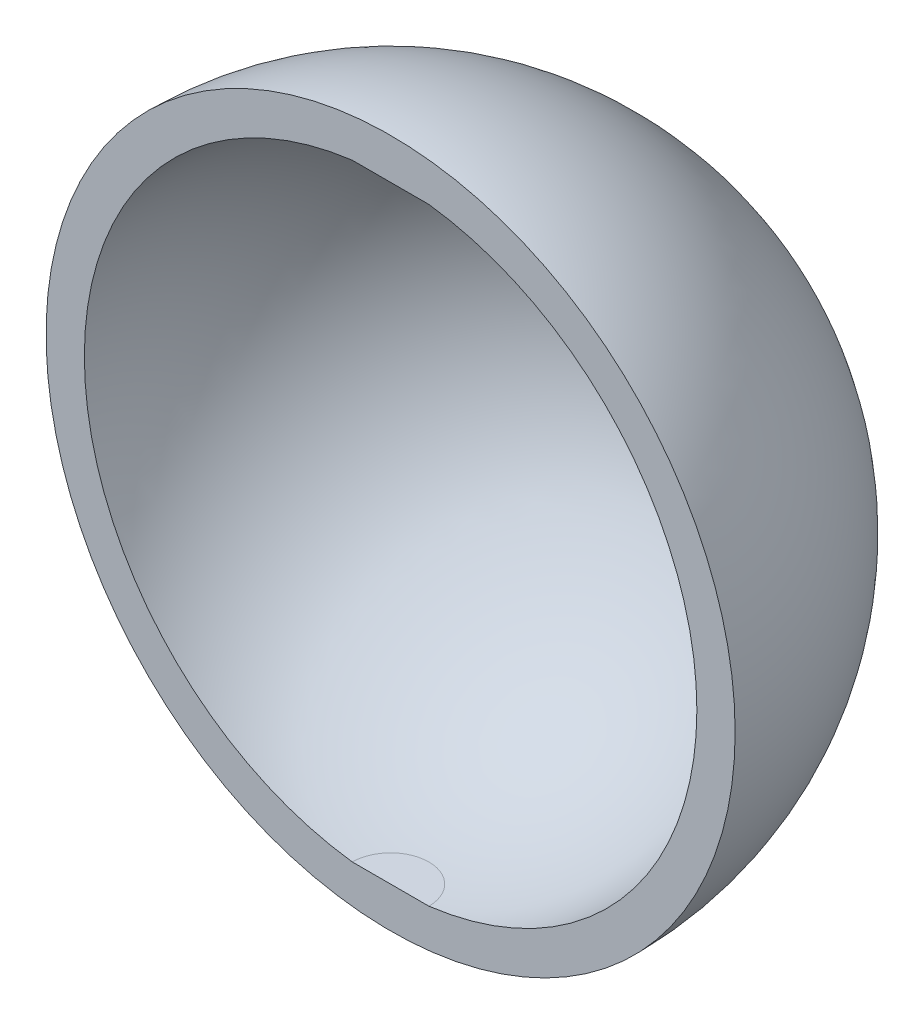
SolidWorks part; units mm, degrees
ref_plane "Front Plane" through (0, 0, 0) normal (0, 0, 1) x (1, 0, 0)
ref_plane "Top Plane" through (0, 0, 0) normal (0, 1, 0) x (1, 0, 0)
ref_plane "Right Plane" through (0, 0, 0) normal (1, 0, 0) x (0, 0, -1)
sketch "Sketch1" plane through (0, 0, 0) normal (0, 0, 1) x (1, 0, 0)
  line L0 (0, 0) -> (0, 3.3742)
  line L2 (3.175, 53.7758) -> (0, 53.7758)
  line L3 (3.175, 3.3742) -> (0, 3.3742)
  line L4 (0, 53.7758) -> (0, 57.15)
  line L5 (3.175, 3.3742) -> (3.175, 53.7758) construction
  line L7 (0, 0) -> (0, 57.15) construction
  arc A0 (0, 57.15) -> (0, 0) centre (0, 28.575) cw
  arc A1 (3.175, 53.7758) -> (3.175, 3.3742) centre (0, 28.575) cw
  dimension "D2" = 28.575
  dimension "D1" = 57.15
  dimension "D3" = 3.175
revolve "Revolve1" add sketch "Sketch1" angle 180 about L0
